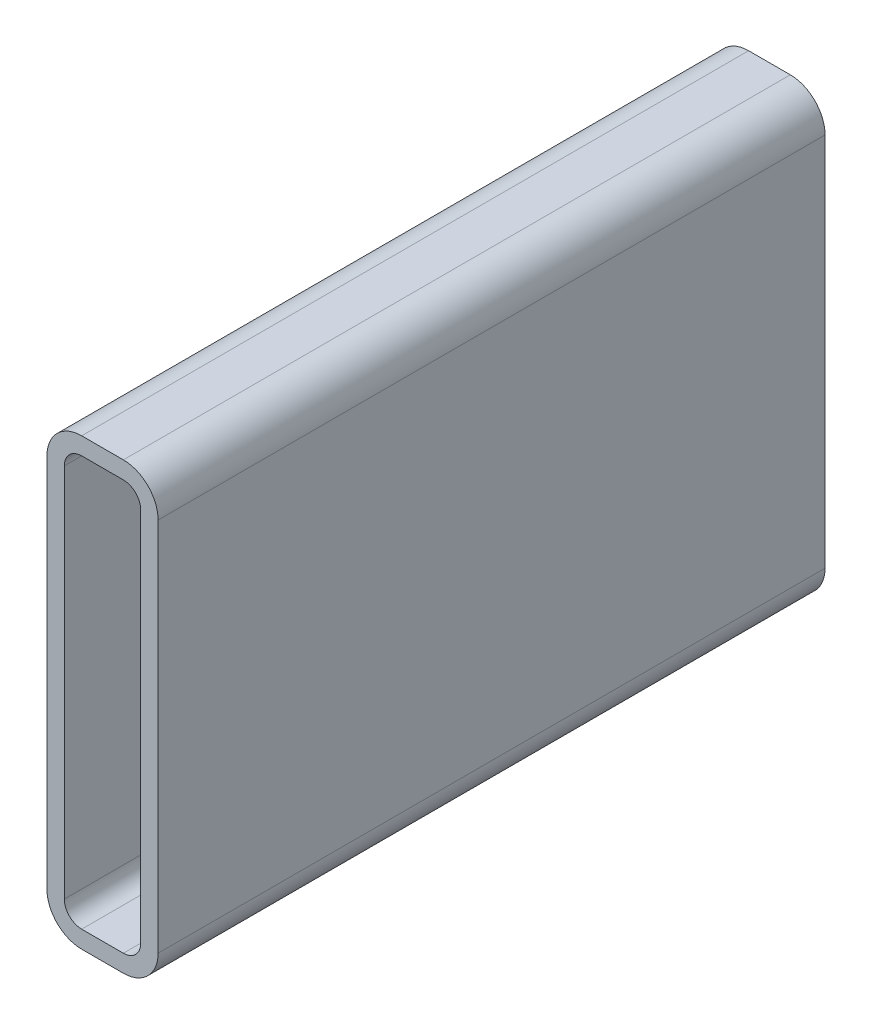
SolidWorks part; units mm, degrees
ref_plane "Front Plane" through (0, 0, 0) normal (0, 0, 1) x (1, 0, 0)
ref_plane "Top Plane" through (0, 0, 0) normal (0, 1, 0) x (1, 0, 0)
ref_plane "Right Plane" through (0, 0, 0) normal (1, 0, 0) x (0, 0, -1)
sketch "Sketch1" plane through (0, 0, 0) normal (0, 0, 1) x (1, 0, 0)
  line B0 (15.875, 203.2) -> (34.925, 203.2)
  arc B1 (50.8, 187.325) -> (34.925, 203.2) centre (34.925, 187.325) ccw
  line B2 (50.8, 187.325) -> (50.8, 15.875)
  arc B3 (34.925, 0) -> (50.8, 15.875) centre (34.925, 15.875) ccw
  line B4 (34.925, 0) -> (15.875, 0)
  arc B5 (0, 15.875) -> (15.875, 0) centre (15.875, 15.875) ccw
  line B6 (0, 15.875) -> (0, 187.325)
  arc B7 (15.875, 203.2) -> (0, 187.325) centre (15.875, 187.325) ccw
  line B8 (15.875, 195.2625) -> (34.925, 195.2625)
  arc B9 (42.8625, 187.325) -> (34.925, 195.2625) centre (34.925, 187.325) ccw
  line B10 (42.8625, 187.325) -> (42.8625, 15.875)
  arc B11 (34.925, 7.9375) -> (42.8625, 15.875) centre (34.925, 15.875) ccw
  line B12 (34.925, 7.9375) -> (15.875, 7.9375)
  arc B13 (7.9375, 15.875) -> (15.875, 7.9375) centre (15.875, 15.875) ccw
  line B14 (7.9375, 15.875) -> (7.9375, 187.325)
  arc B15 (15.875, 195.2625) -> (7.9375, 187.325) centre (15.875, 187.325) ccw
sketch_block_instance "HSS8x2x0.3125-1"
sketch_block "HSS8x2x0.3125"
extrude "Boss-Extrude1" add sketch "Sketch1" along normal blind 304.8
